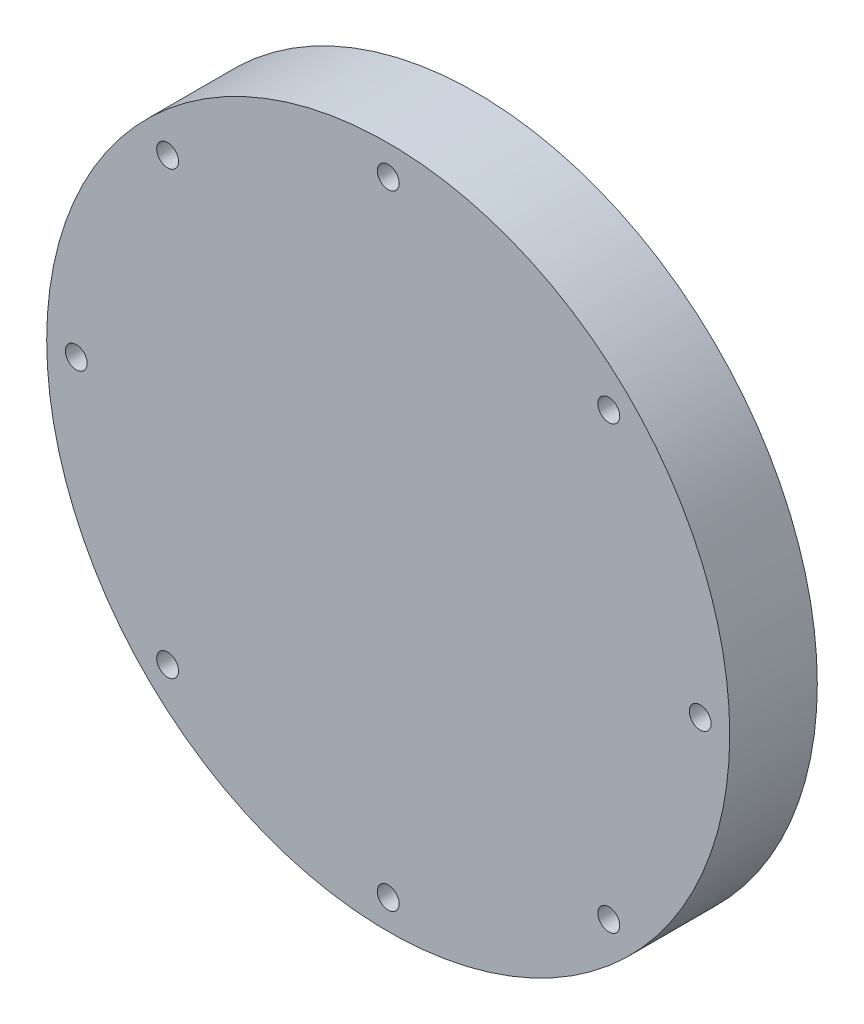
SolidWorks part; units mm, degrees
ref_plane "FRONT" through (0, 0, 0) normal (0, 0, 1) x (1, 0, 0)
ref_plane "TOP" through (0, 0, 0) normal (0, 1, 0) x (1, 0, 0)
ref_plane "RT-SIDE" through (0, 0, 0) normal (1, 0, 0) x (0, 0, -1)
sketch "Sketch1" plane through (0, 0, 0) normal (0, 0, 1) x (1, 0, 0)
  circle A0 centre (0, 0) radius 99.06
  circle A9 centre (0, -90.4875) radius 3.175
  circle A10 centre (-63.9843, -63.9843) radius 3.175
  circle A11 centre (-90.4875, 0) radius 3.175
  circle A12 centre (-63.9843, 63.9843) radius 3.175
  circle A13 centre (0, 90.4875) radius 3.175
  circle A14 centre (63.9843, 63.9843) radius 3.175
  circle A15 centre (90.4875, 0) radius 3.175
  circle A16 centre (63.9843, -63.9843) radius 3.175
  dimension "D1" = 198.12
extrude "Base-Extrude" add sketch "Sketch1" along normal blind 25.4
